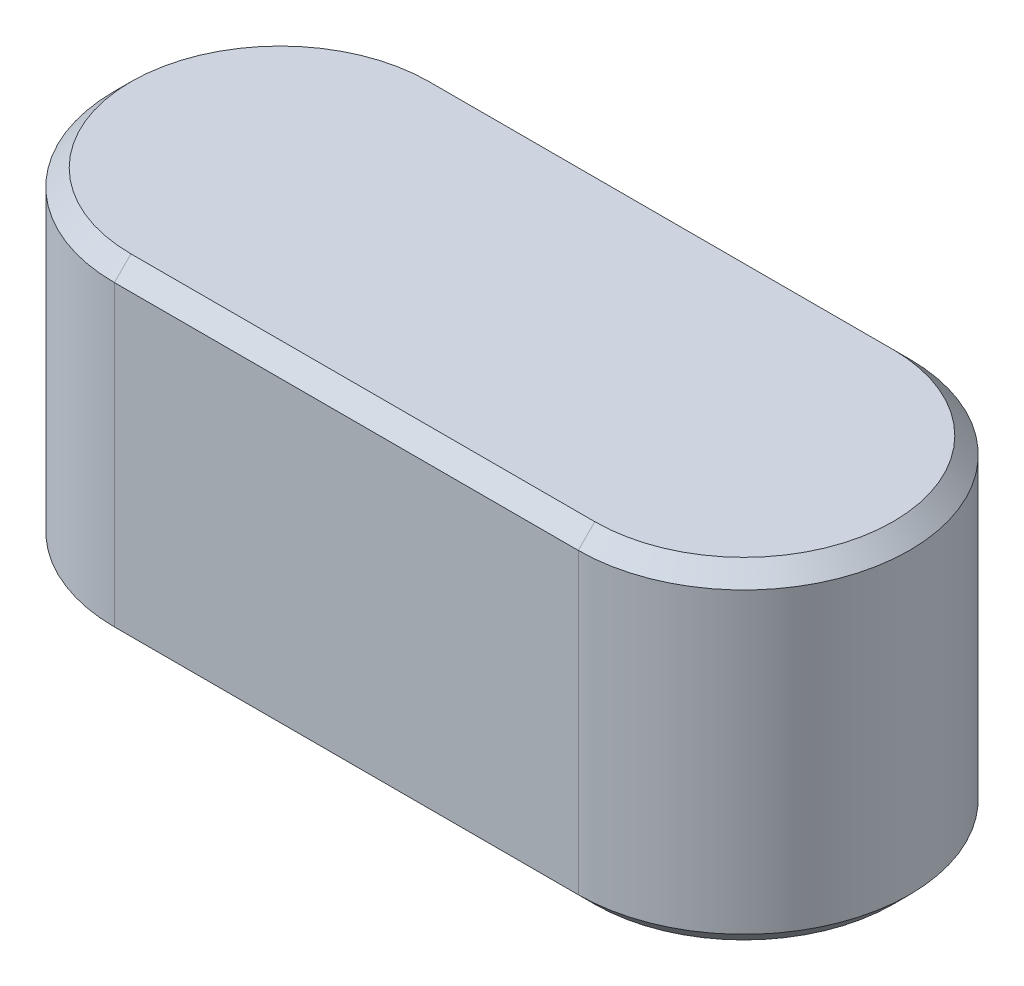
SolidWorks part; units mm, degrees
ref_plane "Plan1" through (0, 0, 0) normal (0, 0, 1) x (1, 0, 0)
ref_plane "Plan2" through (0, 0, 0) normal (0, 1, 0) x (1, 0, 0)
ref_plane "Plan3" through (0, 0, 0) normal (1, 0, 0) x (0, 0, -1)
sketch "Esquisse1" plane through (0, 0, 0) normal (0, 1, 0) x (1, 0, 0)
  line L0 (0, 0) -> (7, 0) construction
  line L1 (7, 2.5) -> (0, 2.5)
  line L2 (7, -2.5) -> (0, -2.5)
  line L3 (-2.5, -2.5) -> (-2.5, 2.5) construction
  line L4 (9.5, -2.5) -> (9.5, 2.5) construction
  arc A0 (0, 2.5) -> (0, -2.5) centre (0, 0) ccw
  arc A1 (7, 2.5) -> (7, -2.5) centre (7, 0) cw
  dimension "a" = 5
  dimension "l" = 12
extrude "Base-Extrusion" add sketch "Esquisse1" along normal blind 5
chamfer "Chanfrein1" distance 0.25 angle 45 8 edges at (9.5, 5, 0) (3.5, 5, -2.5) (-2.5, 5, 0) (3.5, 0, -2.5) (9.5, 0, 0) (3.5, 0, 2.5) (-2.5, 0, 0) (3.5, 5, 2.5)
ref_plane "Plan-tangent-arbre" through (0, 3, 0) normal (0, 1, 0) x (-1, 0, 0)
sketch "Section-rainure-alesage" plane through (0, 0, 0) normal (1, 0, 0) x (0, 0, -1)
  line L0 (2.5, 3) -> (2.5, 5.3) construction
  line L1 (50, 3) -> (-50, 3) construction
  line L2 (2.5, 5.3) -> (-2.5, 5.3) construction
  line L3 (-2.5, 5.3) -> (-2.5, 3) construction
  line L4 (-2.5, 3) -> (2.5, 3) construction
  line L5 (-2.5, 4.75) -> (-2.5, 0.25) construction
  line L6 (2.5, 4.75) -> (2.5, 0.25) construction
  dimension "k-d" = 2.3
